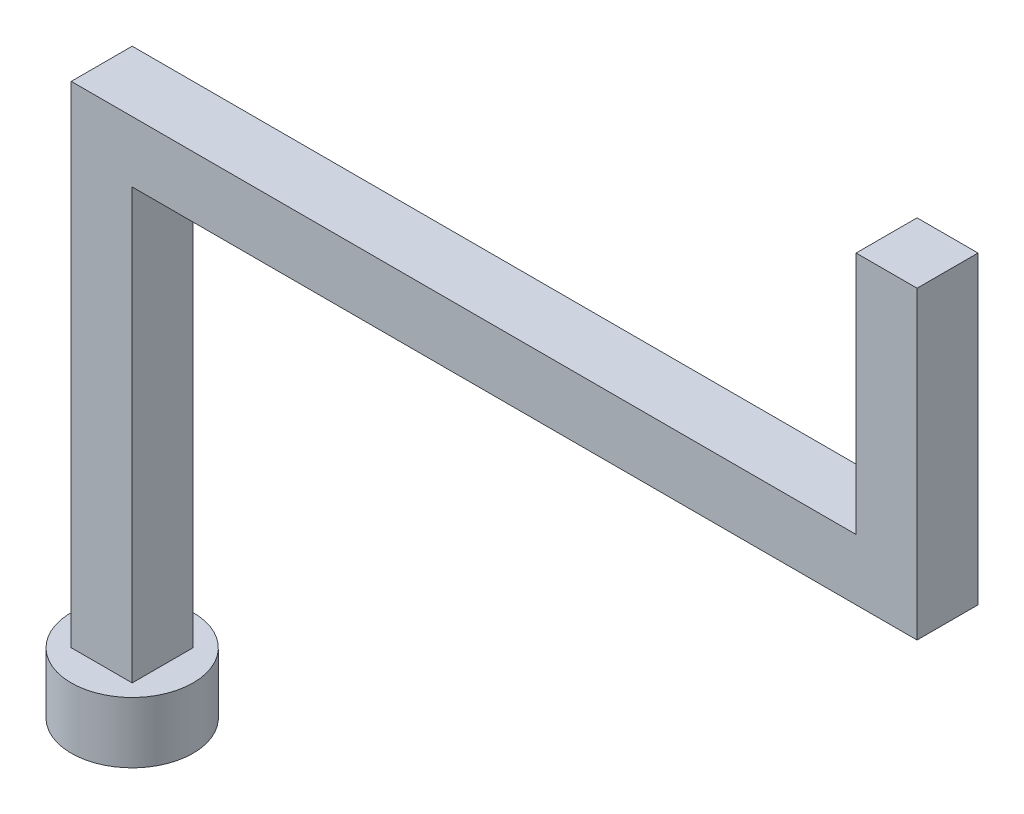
SolidWorks part; units mm, degrees
ref_plane "Front Plane" through (0, 0, 0) normal (0, 0, 1) x (1, 0, 0)
ref_plane "Top Plane" through (0, 0, 0) normal (0, 1, 0) x (1, 0, 0)
ref_plane "Right Plane" through (0, 0, 0) normal (1, 0, 0) x (0, 0, -1)
sketch "Sketch1" plane through (0, 0, 0) normal (0, 0, 1) x (1, 0, 0)
  line L0 (0, 0) -> (-3.175, 0)
  line L1 (0, 0) -> (0, 12.7)
  line L2 (-3.175, 0) -> (-3.175, 15.875)
  line L3 (-3.175, 25.5529) -> (37.7136, 25.5529)
  line L4 (40.8886, 25.5529) -> (40.8886, 22.3779)
  line L5 (40.8886, 22.3779) -> (0, 22.3779)
  line L6 (40.8886, 25.5529) -> (40.8886, 28.9204)
  line L7 (37.7136, 25.5529) -> (37.7136, 38.2529)
  line L8 (37.7136, 38.2529) -> (40.8886, 38.2529)
  line L9 (40.8886, 38.2529) -> (40.8886, 28.9204)
  line L10 (0, 12.7) -> (0, 22.3779)
  line L11 (-3.175, 15.875) -> (-3.175, 25.5529)
extrude "Boss-Extrude1" add sketch "Sketch1" along normal blind 3.175
sketch "Sketch2" plane through (0, 0, 0) normal (0, -1, 0) x (1, 0, 0)
  line L0 (-3.175, 3.175) -> (0, 0) construction
  line L1 (-3.175, 0) -> (0, 3.175) construction
  circle A0 centre (-1.5875, 1.5875) radius 3.175
extrude "Boss-Extrude2" add sketch "Sketch2" along normal blind 3.175
